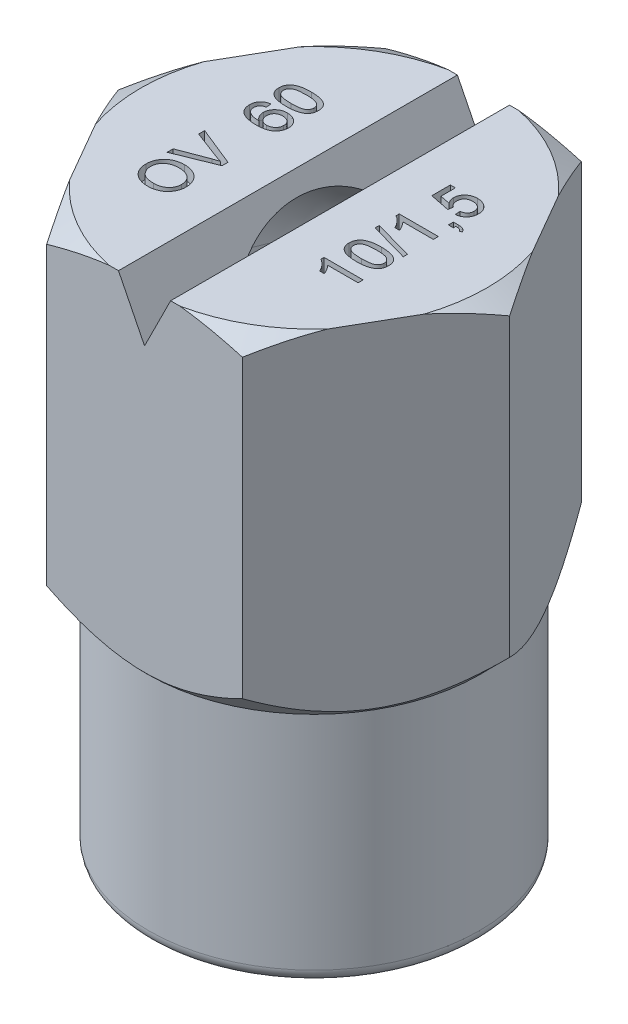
SolidWorks part; units mm, degrees
ref_plane "Anteriore" through (0, 0, 0) normal (0, 0, 1) x (1, 0, 0)
ref_plane "Superiore" through (0, 0, 0) normal (0, 1, 0) x (1, 0, 0)
ref_plane "Destro" through (0, 0, 0) normal (1, 0, 0) x (0, 0, -1)
sketch "Schizzo1" plane through (0, 0, 0) normal (0, 1, 0) x (1, 0, 0)
  line L1 (3.7528, -6.5) -> (7.5056, 0)
  line L2 (7.5056, 0) -> (3.7528, 6.5)
  line L3 (3.7528, 6.5) -> (-3.7528, 6.5)
  line L4 (-3.7528, 6.5) -> (-7.5056, 0)
  line L5 (-7.5056, 0) -> (-3.7528, -6.5)
  line L6 (-3.7528, -6.5) -> (3.7528, -6.5)
  circle A0 centre (0, 0) radius 6.5 construction
  dimension "D1" = 13
extrude "Estrusione1" add sketch "Schizzo1" along normal blind 22
sketch "Schizzo2" plane through (0, 0, 6.5) normal (0, 0, 1) x (1, 0, 0)
  line L0 (-1, 22) -> (0, 20)
  line L1 (0, 20) -> (1, 22)
  line L2 (1, 22) -> (-1, 22)
  line L3 (0, 20) -> (0, 22) construction
  line L4 (-3.7528, 22) -> (3.7528, 22) construction
  dimension "D1" = 2
  dimension "D2" = 2
extrude "Taglio-Estrusione1" cut sketch "Schizzo2" against normal through all
sketch "Schizzo3" plane through (0, 0, 0) normal (0, 0, 1) x (1, 0, 0)
  line L0 (3.75, 0) -> (3.75, 17.65)
  line L1 (0, 21.4) -> (0, 0)
  line L2 (0, 0) -> (3.75, 0)
  line L3 (1, 22) -> (3.7528, 22) construction
  line L4 (0, 0) -> (0, 39) construction
  arc A0 (3.75, 17.65) -> (0, 21.4) centre (0, 17.65) ccw
  dimension "D1" = 3.75
  dimension "D2" = 0.6
revolve "Taglia-Rivoluzione1" cut sketch "Schizzo3" angle 360 about L4
sketch "Schizzo4" plane through (0, 0, 0) normal (0, -1, 0) x (1, 0, 0)
  circle A0 centre (0, 0) radius 6.35
  circle A1 centre (0, 0) radius 16.35
  dimension "D1" = 12.7
  dimension "D2" = 10
extrude "Taglio-Estrusione2" cut sketch "Schizzo4" against normal blind 9
sketch "Schizzo5" plane through (0, 0, 0) normal (0, 0, 1) x (1, 0, 0)
  line L0 (3, 24.1013) -> (10.5056, 19.7679)
  line L1 (0, 0) -> (0, 39) construction
  line L5 (7.5056, 22) -> (7.5056, 9) construction
  line L7 (3.7528, 22) -> (7.5056, 22) construction
  line L8 (3, 24.1013) -> (10.5056, 24.1013)
  line L9 (10.5056, 24.1013) -> (10.5056, 19.7679)
  point P4 (7.5056, 21.5)
  dimension "D1" = 60
  dimension "D2" = 0.5
  dimension "D3" = 3
  dimension "D4" = 3
revolve "Taglia-Rivoluzione4" cut sketch "Schizzo5" angle 360 about axis through (0, 0, 0) along (0, 1, 0)
sketch "Schizzo6" plane through (0, 0, 0) normal (0, 0, 1) x (1, 0, 0)
  line L0 (8.35, 11) -> (6.35, 9)
  line L1 (7.5056, 9) -> (3.7528, 9) construction
  line L2 (6.35, 9) -> (8.35, 9)
  line L3 (8.35, 9) -> (8.35, 11)
  line L4 (6.35, 0) -> (6.35, 9) construction
  dimension "D1" = 45
  dimension "D2" = 2
revolve "Taglia-Rivoluzione5" cut sketch "Schizzo6" angle 360 about axis through (0, 0, 0) along (0, 1, 0)
chamfer "Smusso1" distance 1 angle 45 1 edges at (0, 0, -3.75)
fillet "Raccordo1" radius 0.5 1 edges at (0, 0, -6.35)
sketch "Schizzo7" plane through (0, 22, 0) normal (0, 1, 0) x (-1, 0, 0)
  line L2 (2.5, 6.1509) -> (2.5, -6.1509) construction
  line L3 (1, -6.5) -> (1, 6.5) construction
  arc A0 (4.9522, 4.4226) -> (1.354, 6.5) centre (0, 0) ccw construction
  arc A2 (1.354, -6.5) -> (4.9522, -4.4226) centre (0, 0) ccw construction
  text T0 "OV  60" font "Arial" height 1.5
  dimension "D1" = 1.5
extrude "Taglio-Estrusione3" cut sketch "Schizzo7" against normal blind 0.5
sketch "Schizzo8" plane through (0, 22, 0) normal (0, 1, 0) x (-1, 0, 0)
  line L1 (-4, 5.2994) -> (-4, -5.2994) construction
  line L2 (-1, -6.5) -> (-1, 6.5) construction
  arc A0 (-1.354, 6.5) -> (-4.9522, 4.4226) centre (0, 0) ccw construction
  arc A2 (-4.9522, -4.4226) -> (-1.354, -6.5) centre (0, 0) ccw construction
  text T0 "10/1,5" font "Arial" height 1.5
  dimension "D1" = 3
extrude "Taglio-Estrusione4" cut sketch "Schizzo8" against normal blind 0.5
